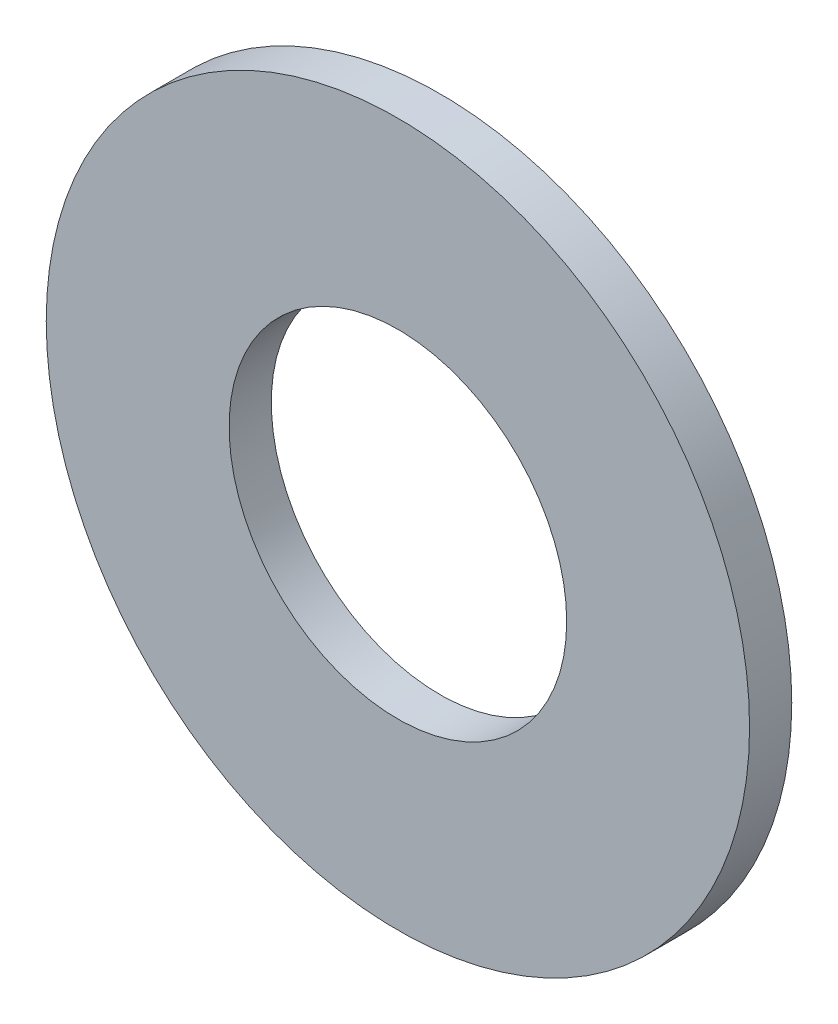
SolidWorks part; units mm, degrees
ref_plane "Front Plane" through (0, 0, 0) normal (0, 0, 1) x (1, 0, 0)
ref_plane "Top Plane" through (0, 0, 0) normal (0, 1, 0) x (1, 0, 0)
ref_plane "Right Plane" through (0, 0, 0) normal (1, 0, 0) x (0, 0, -1)
sketch "Sketch1" plane through (0, 0, 0) normal (0, 0, 1) x (1, 0, 0)
  circle A0 centre (0, 0) radius 9.525
  circle A1 centre (0, 0) radius 19.8438
  dimension "D1" = 19.05
  dimension "D2" = 39.6875
extrude "5906k549" add sketch "Sketch1" against normal blind 2.3813
